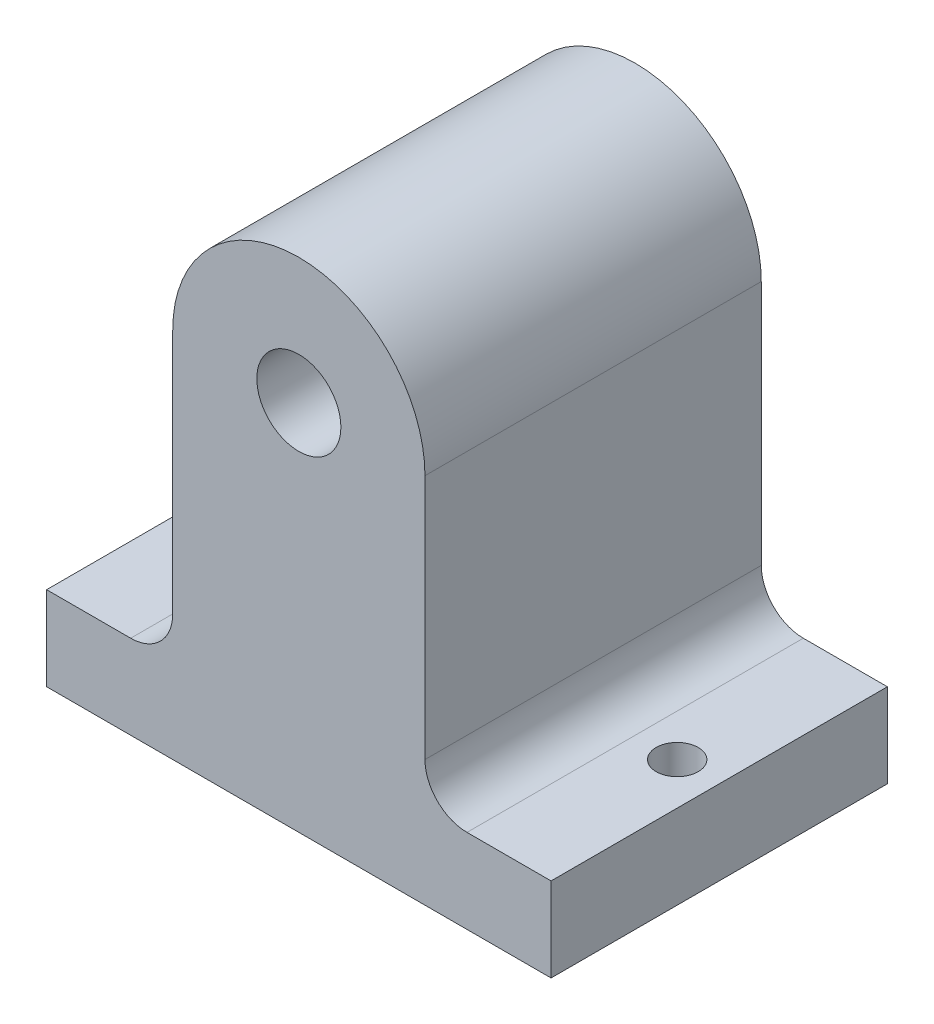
SolidWorks part; units mm, degrees
ref_plane "Front Plane" through (0, 0, 0) normal (0, 0, 1) x (1, 0, 0)
ref_plane "Top Plane" through (0, 0, 0) normal (0, 1, 0) x (1, 0, 0)
ref_plane "Right Plane" through (0, 0, 0) normal (1, 0, 0) x (0, 0, -1)
sketch "Sketch1" plane through (0, 0, 0) normal (0, 0, 1) x (1, 0, 0)
  line L0 (-9.525, 0) -> (-9.525, -28.0909)
  line L1 (-9.525, -28.0909) -> (9.525, -28.0909)
  line L2 (9.525, -28.0909) -> (9.525, 0)
  line L4 (-19.05, -28.0909) -> (19.05, -28.0909)
  line L5 (-19.05, -28.0909) -> (-19.05, -21.7409)
  line L6 (-19.05, -21.7409) -> (19.05, -21.7409)
  line L7 (19.05, -28.0909) -> (19.05, -21.7409)
  circle A0 centre (0, 0) radius 3.175
  circle A1 centre (0, 0) radius 9.525
  point P12 (-19.05, -14.8659)
  dimension "D1" = 6.35
  dimension "D2" = 19.05
  dimension "D3" = 28.0909
  dimension "D4" = 6.35
  dimension "D5" = 38.1
  dimension "D6" = 9.525
  dimension "D7" = 0
extrude "Boss-Extrude1" add sketch "Sketch1" along normal blind 25.4 contours A1 A0 | A1 L0 L6 L2 | L6 L0 L1 L2 | L6 L5 L4 L0 | L4 L7 L6 L2
fillet "Fillet1" radius 3.175 2 edges at (9.525, -21.7409, 12.7) (-9.525, -21.7409, 12.7)
sketch "Sketch2" plane through (0, -21.7409, 0) normal (0, 1, 0) x (1, 0, 0)
  line L0 (-19.05, 0) -> (-12.7, 0) construction
  line L1 (12.7, 0) -> (19.05, 0) construction
  line L2 (19.05, -25.4) -> (19.05, 0) construction
  line L3 (-19.05, -25.4) -> (-19.05, 0) construction
  circle A0 centre (-15.875, -12.7) radius 1.5875
  circle A1 centre (15.875, -12.7) radius 1.5875
  dimension "D1" = 12.7
  dimension "D2" = 12.7
  dimension "D3" = 3.175
  dimension "D4" = 3.175
  dimension "D5" = 3.175
  dimension "D6" = 3.175
extrude "Cut-Extrude1" cut sketch "Sketch2" against normal blind 25.4
